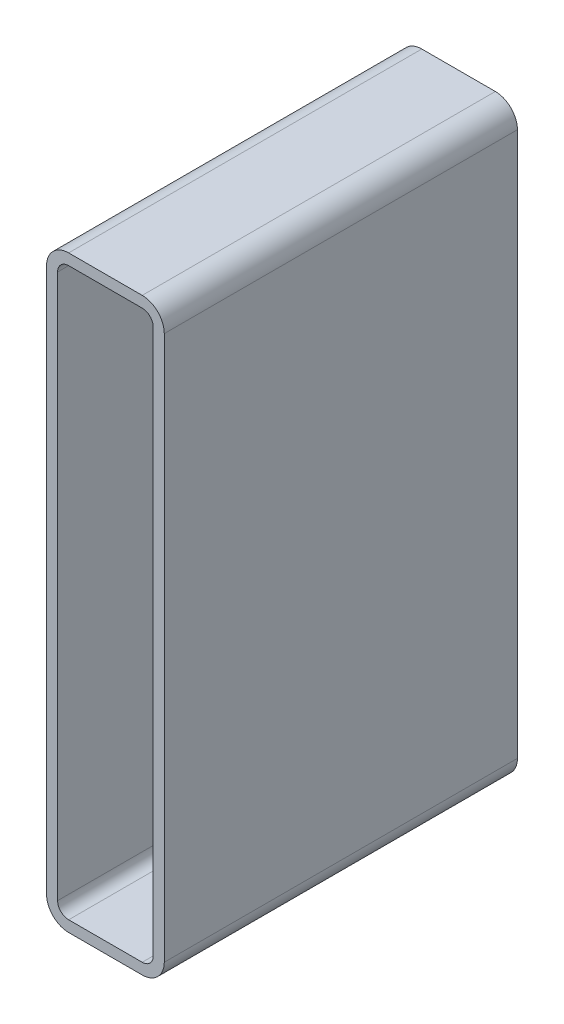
SolidWorks part; units mm, degrees
ref_plane "Front Plane" through (0, 0, 0) normal (0, 0, 1) x (1, 0, 0)
ref_plane "Top Plane" through (0, 0, 0) normal (0, 1, 0) x (1, 0, 0)
ref_plane "Right Plane" through (0, 0, 0) normal (1, 0, 0) x (0, 0, -1)
sketch "Sketch1" plane through (0, 0, 0) normal (0, 0, 1) x (1, 0, 0)
sketch_block_instance "HSS20x4x0.375-1"
sketch_block "HSS20x4x0.375"
extrude "Boss-Extrude1" add sketch "Sketch1" along normal blind 304.8
